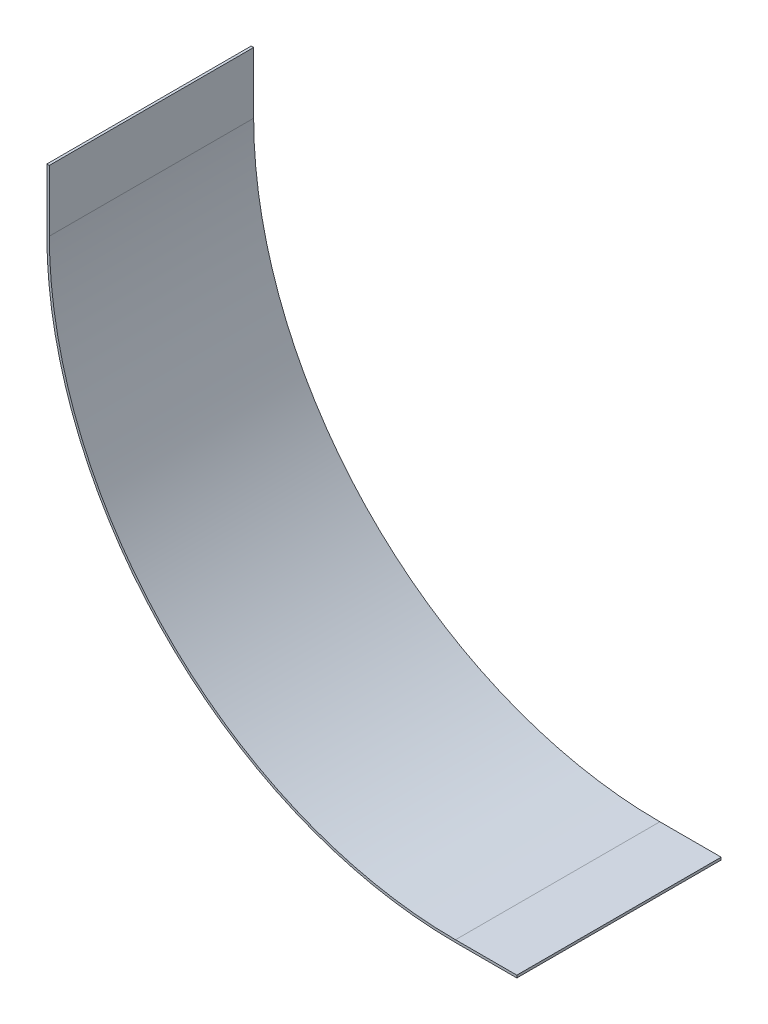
SolidWorks part; units mm, degrees
ref_plane "Front Plane" through (0, 0, 0) normal (0, 0, 1) x (1, 0, 0)
ref_plane "Top Plane" through (0, 0, 0) normal (0, 1, 0) x (1, 0, 0)
ref_plane "Right Plane" through (0, 0, 0) normal (1, 0, 0) x (0, 0, -1)
sketch "Sketch1" plane through (0, 0, 0) normal (0, 0, 1) x (1, 0, 0)
  line L0 (0, 0) -> (100, 0) construction
  line L1 (100, 0) -> (100, -30) construction
  line L2 (200, -130) -> (230, -130) construction
  line L3 (230, -130) -> (230, -230) construction
  line L4 (230, -230) -> (200, -230)
  line L5 (0, -30) -> (0, 0)
  arc A0 (100, -30) -> (200, -130) centre (200, -30) ccw construction
  arc A1 (200, -230) -> (0, -30) centre (200, -30) cw
  dimension "D2" = 90
  dimension "D1" = 100
  dimension "D3" = 100
  dimension "D4" = 30
extrude "Extrude-Thin1" add sketch "Sketch1" along normal blind 100 thin
